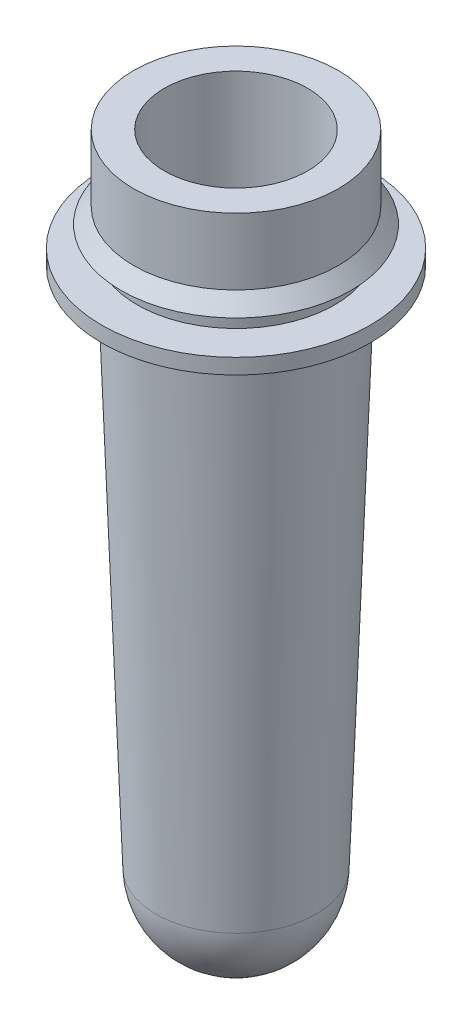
SolidWorks part; units mm, degrees
ref_plane "Front Plane" through (0, 0, 0) normal (0, 0, 1) x (1, 0, 0)
ref_plane "Top Plane" through (0, 0, 0) normal (0, 1, 0) x (1, 0, 0)
ref_plane "Right Plane" through (0, 0, 0) normal (1, 0, 0) x (0, 0, -1)
sketch "Sketch1" plane through (0, 0, 0) normal (1, 0, 0) x (0, 0, -1)
  line L0 (0, 0) -> (0, 70) construction
  line L1 (0, 70) -> (10, 70)
  line L2 (10, 70) -> (10, 63.5)
  line L3 (9.6508, 60) -> (13.0984, 60)
  line L4 (13.0984, 60) -> (13.0984, 58.5)
  line L5 (13.0984, 58.5) -> (9.5984, 58.5)
  line L6 (9.5984, 58.5) -> (7.8192, 7.5509)
  line L7 (10, 63.5) -> (11.2206, 62)
  line L8 (11.2206, 62) -> (9.7206, 62)
  line L9 (9.7206, 62) -> (9.6508, 60)
  line L10 (9.7206, 62) -> (9.6508, 60)
  line L11 (0, 0) -> (-9.6409, 0) construction
  arc A0 (7.8192, 7.5509) -> (0, 0) centre (0, 7.824) cw
  dimension "D1" = 70
  dimension "D2" = 10
  dimension "D3" = 2
  dimension "D4" = 1.5
  dimension "D5" = 3.5
  dimension "D6" = 10
  dimension "D7" = 2
  dimension "D8" = 1.5
  dimension "D9" = 1.5
  dimension "D11" = 90
  dimension "D12" = 9.7206
sketch "Sketch2" plane through (0, 0, 0) normal (1, 0, 0) x (0, 0, -1)
  line L0 (0, 0) -> (0, 70) construction
  line L1 (9.6508, 60) -> (13.0984, 60) construction
  line L2 (13.0984, 60) -> (13.0984, 58.5) construction
  line L3 (13.0984, 58.5) -> (9.5984, 58.5) construction
  line L4 (9.5984, 58.5) -> (7.8192, 7.5509) construction
  line L5 (9.7206, 62) -> (9.6508, 60) construction
  line L6 (0, 70) -> (10, 70) construction
  line L7 (10, 70) -> (10, 63.5) construction
  line L8 (10, 63.5) -> (11.2206, 62) construction
  line L9 (11.2206, 62) -> (9.7206, 62) construction
  line L10 (0, 0) -> (0, 70) construction
  line L11 (9.6508, 60) -> (13.0984, 60)
  line L12 (13.0984, 60) -> (13.0984, 58.5)
  line L13 (13.0984, 58.5) -> (9.5984, 58.5)
  line L14 (9.5984, 58.5) -> (7.8192, 7.5509)
  line L15 (9.7206, 62) -> (9.6508, 60)
  line L16 (0, 70) -> (10, 70) construction
  line L17 (10, 70) -> (10, 63.5)
  line L18 (10, 63.5) -> (11.2206, 62)
  line L19 (11.2206, 62) -> (9.7206, 62)
  line L20 (7, 70) -> (7, 60)
  line L21 (7, 70.0524) -> (6.9982, 70)
  line L22 (9.5984, 58.5) -> (0, 58.5) construction
  line L23 (6.5966, 58.5) -> (4.8211, 7.6556)
  line L24 (7, 60) -> (6.5966, 58.5)
  line L25 (10, 70) -> (6.9982, 70)
  line L26 (0, 3) -> (0, 0)
  arc A0 (0, 0) -> (7.8192, 7.5509) centre (0, 7.824) ccw construction
  arc A1 (0, 0) -> (7.8192, 7.5509) centre (0, 7.824) ccw
  arc A2 (4.8211, 7.6556) -> (0, 3) centre (0, 7.824) cw
  dimension "D1" = 3
  dimension "D2" = 3
  dimension "D3" = 3
  dimension "D4" = 1.5
revolve "Revolve1" add sketch "Sketch2" angle 360 about L10
